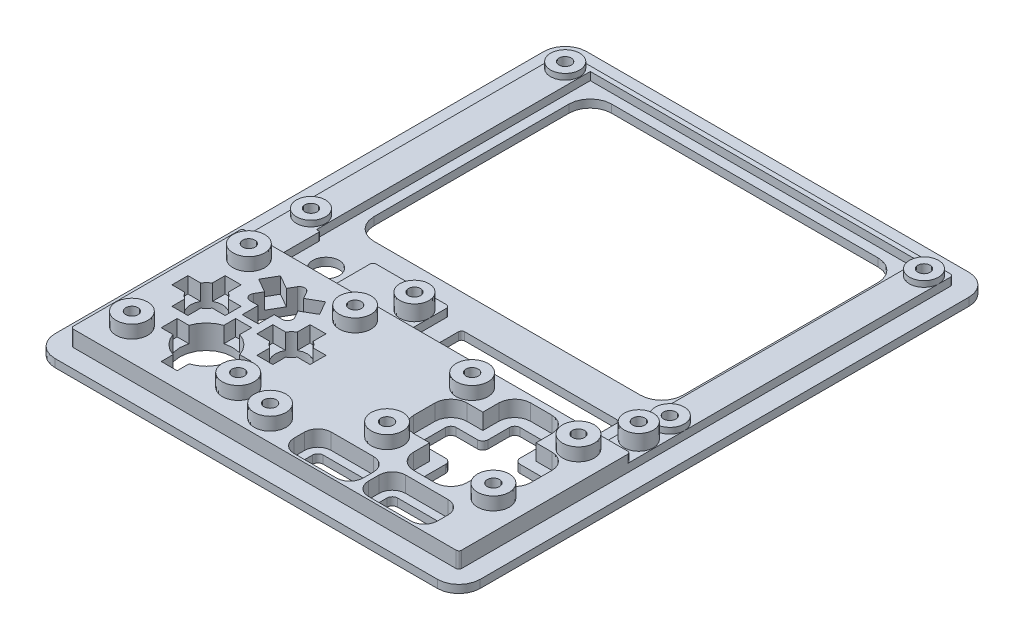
SolidWorks part; units mm, degrees
ref_plane "Front Plane" through (0, 0, 0) normal (0, 0, 1) x (1, 0, 0)
ref_plane "Top Plane" through (0, 0, 0) normal (0, 1, 0) x (1, 0, 0)
ref_plane "Right Plane" through (0, 0, 0) normal (1, 0, 0) x (0, 0, -1)
sketch "Sketch1" plane through (0, 0, 0) normal (0, 1, 0) x (1, 0, 0)
  line L1 (50.8, -63.5) -> (-50.8, -63.5)
  line L2 (50.8, -63.5) -> (50.8, 63.5)
  line L3 (50.8, 63.5) -> (-50.8, 63.5)
  line L4 (-50.8, -63.5) -> (-50.8, 63.5)
  line L5 (50.8, -63.5) -> (-50.8, 63.5) construction
  line L6 (50.8, 63.5) -> (-50.8, -63.5) construction
  point P0 (0, 0)
  dimension "D1" = 101.6
  dimension "D2" = 127
extrude "Boss-Extrude1" add sketch "Sketch1" along normal blind 3.81
fillet "Fillet1" radius 5.08 4 edges at (-50.8, 1.905, -63.5) (50.8, 1.905, -63.5) (-50.8, 1.905, 63.5) (50.8, 1.905, 63.5)
sketch "Sketch2" plane through (0, 3.81, 0) normal (0, 1, 0) x (1, 0, 0)
  line L0 (-46.355, 58.42) -> (-46.355, -58.42)
  line L1 (-45.72, -59.055) -> (45.72, -59.055)
  line L2 (46.355, -58.42) -> (46.355, 58.42)
  line L3 (45.72, 59.055) -> (-45.72, 59.055)
  line L4 (45.72, 63.5) -> (-45.72, 63.5)
  line L5 (-50.8, 58.42) -> (-50.8, -58.42)
  line L6 (-45.72, -63.5) -> (45.72, -63.5)
  line L7 (50.8, -58.42) -> (50.8, 58.42)
  line L8 (45.72, 63.5) -> (-45.72, 63.5)
  line L9 (-50.8, 58.42) -> (-50.8, -58.42)
  line L10 (-45.72, -63.5) -> (45.72, -63.5)
  line L11 (50.8, -58.42) -> (50.8, 58.42)
  arc A0 (-45.72, 59.055) -> (-46.355, 58.42) centre (-45.72, 58.42) ccw
  arc A1 (-46.355, -58.42) -> (-45.72, -59.055) centre (-45.72, -58.42) ccw
  arc A2 (45.72, -59.055) -> (46.355, -58.42) centre (45.72, -58.42) ccw
  arc A3 (46.355, 58.42) -> (45.72, 59.055) centre (45.72, 58.42) ccw
  arc A5 (-45.72, 63.5) -> (-50.8, 58.42) centre (-45.72, 58.42) ccw
  arc A6 (-50.8, -58.42) -> (-45.72, -63.5) centre (-45.72, -58.42) ccw
  arc A7 (45.72, -63.5) -> (50.8, -58.42) centre (45.72, -58.42) ccw
  arc A8 (50.8, 58.42) -> (45.72, 63.5) centre (45.72, 58.42) ccw
  arc A9 (-45.72, 63.5) -> (-50.8, 58.42) centre (-45.72, 58.42) ccw
  arc A10 (-50.8, -58.42) -> (-45.72, -63.5) centre (-45.72, -58.42) ccw
  arc A11 (45.72, -63.5) -> (50.8, -58.42) centre (45.72, -58.42) ccw
  arc A12 (50.8, 58.42) -> (45.72, 63.5) centre (45.72, 58.42) ccw
  dimension "D1" = 0
  dimension "D2" = 4.445
extrude "Cut-Extrude1" cut sketch "Sketch2" against normal blind 1.905
sketch "Sketch3" plane through (0, 3.81, 0) normal (0, 1, 0) x (1, 0, 0)
  line L14 (-39.212, 57.912) -> (-39.212, -7.512)
  line L15 (-38.45, 57.15) -> (38.45, 57.15) construction
  line L16 (-38.45, 57.15) -> (-38.45, -6.75) construction
  line L17 (-38.45, -6.75) -> (38.45, -6.75) construction
  line L18 (38.45, 57.15) -> (38.45, -6.75) construction
  line L19 (-39.212, -7.512) -> (39.212, -7.512)
  line L20 (39.212, 57.912) -> (39.212, -7.512)
  line L21 (-39.212, 57.912) -> (39.212, 57.912)
  dimension "D1" = 0.762
extrude "Cut-Extrude2" cut sketch "Sketch3" against normal blind 1.905
sketch "Sketch4" plane through (0, 0, 0) normal (0, -1, 0) x (1, 0, 0)
  line L19 (36.926, -55.626) -> (36.926, 1.162)
  line L20 (-36.926, -55.626) -> (36.926, -55.626)
  line L21 (-36.926, 1.162) -> (-36.926, -55.626)
  line L22 (36.926, 1.162) -> (-36.926, 1.162)
  line L23 (36.926, -55.626) -> (36.926, 1.162)
  line L24 (-36.926, -55.626) -> (36.926, -55.626)
  line L25 (-36.926, 1.162) -> (-36.926, -55.626)
  line L26 (36.926, 1.162) -> (-36.926, 1.162)
  dimension "D1" = 0.508
extrude "Cut-Extrude3" cut sketch "Sketch4" against normal through all
fillet "Fillet2" radius 5.08 4 edges at (-36.926, 0.9525, 1.162) (36.926, 0.9525, 1.162) (36.926, 0.9525, -55.626) (-36.926, 0.9525, -55.626)
sketch "Sketch6" plane through (0, 3.81, 0) normal (0, 1, 0) x (1, 0, 0)
  line L18 (39.212, -18.0784) -> (39.212, -6.75)
  line L19 (-7.397, -18.0784) -> (39.212, -18.0784)
  line L20 (39.212, -6.75) -> (-7.397, -6.75)
  line L21 (-7.397, -6.75) -> (-7.397, -18.0784)
  line L22 (39.212, -18.0784) -> (39.212, -6.75)
  line L23 (-7.397, -18.0784) -> (39.212, -18.0784)
  line L24 (39.212, -6.75) -> (-7.397, -6.75)
  line L25 (-7.397, -6.75) -> (-7.397, -18.0784)
  dimension "D1" = 0.762
extrude "Cut-Extrude4" cut sketch "Sketch6" against normal up to surface (1.905 mm away)
sketch "Sketch8" plane through (0, 0, 0) normal (0, -1, 0) x (1, 0, 0)
  line L12 (-2.5075, 13.6842) -> (-2.5075, 11.1442) construction
  line L13 (34.3225, 11.1442) -> (34.3225, 13.6842) construction
  line L14 (36.926, 9.036) -> (36.926, 15.7924)
  line L15 (-5.111, 9.036) -> (36.926, 9.036)
  line L16 (36.926, 15.7924) -> (-5.111, 15.7924)
  line L17 (-5.111, 15.7924) -> (-5.111, 9.036)
  line L18 (34.8305, 9.036) -> (34.8305, 15.7924)
  line L19 (-3.0155, 9.036) -> (34.8305, 9.036)
  line L20 (34.8305, 15.7924) -> (-3.0155, 15.7924)
  line L21 (-3.0155, 15.7924) -> (-3.0155, 9.036)
  dimension "D2" = 0.508
  dimension "D3" = 0.508
  dimension "D1" = 1.524
extrude "Cut-Extrude7" cut sketch "Sketch8" against normal up to surface (1.905 mm away)
sketch "Sketch9" plane through (0, 3.81, 0) normal (0, 1, 0) x (1, 0, 0)
  line L0 (-6.635, -17.3164) -> (-6.635, -7.512) construction
  circle A0 centre (-32.035, -12.4142) radius 3.175
  point P4 (-6.635, -12.4142)
  dimension "D1" = 6.35
  dimension "D2" = 25.4
extrude "Cut-Extrude8" cut sketch "Sketch9" against normal up to surface (3.81 mm away)
sketch "Sketch10" plane through (0, 3.81, 0) normal (0, 1, 0) x (1, 0, 0)
  line L1 (-38.385, -18.0784) -> (-25.685, -18.0784)
  line L2 (-38.385, -18.0784) -> (-38.385, -6.75)
  line L3 (-38.385, -6.75) -> (-25.685, -6.75)
  line L4 (-25.685, -18.0784) -> (-25.685, -6.75)
  line L5 (-38.385, -18.0784) -> (-25.685, -6.75) construction
  line L6 (-38.385, -6.75) -> (-25.685, -18.0784) construction
  line L8 (38.45, -6.75) -> (-38.45, -6.75) construction
  point P0 (-32.035, -12.4142)
  dimension "D1" = 12.7
extrude "Cut-Extrude9" cut sketch "Sketch10" against normal up to surface (1.905 mm away)
sketch "Sketch11" plane through (0, 3.81, 0) normal (0, 1, 0) x (1, 0, 0)
  line L0 (-46.355, 58.42) -> (-46.355, -58.42) construction
  line L1 (45.72, 59.055) -> (-45.72, 59.055) construction
  line L2 (0, 57.15) -> (0, -7.512) construction
  line L5 (-39.212, 25.2) -> (39.212, 25.2) construction
  line L6 (-39.212, 57.912) -> (-39.212, -7.512) construction
  line L7 (39.212, -18.0784) -> (39.212, 57.912) construction
  line L8 (-6.635, -7.512) -> (38.45, -7.512) construction
  line L9 (-38.45, 57.15) -> (38.45, 57.15) construction
  circle A0 centre (-42.8625, 55.5625) radius 3.4925
  circle A1 centre (42.8625, 55.5625) radius 3.4925
  circle A2 centre (42.8625, -5.1625) radius 3.4925
  circle A3 centre (-42.8625, -5.1625) radius 3.4925
  dimension "D1" = 6.985
extrude "Boss-Extrude2" add sketch "Sketch11" along normal up to surface (1.397 mm away)
hole_wizard "#4 Clearance Hole1" positions "Sketch13" profile "Sketch12" hole size "#4" standard "ANSI Inch"
sketch "Sketch13" plane through (0, 5.207, 0) normal (0, 1, 0) x (1, 0, 0)
  point P0 (-42.8625, 55.5625)
  point P3 (42.8625, 55.5625)
  point P6 (-42.8625, -5.1625)
  point P9 (42.8625, -5.1625)
sketch "Sketch12" plane through (-42.8625, 5.207, -55.5625) normal (1, 0, 0) x (0, 0, 1)
  line L0 (0, 0) -> (0, 4.6952)
  line L1 (0, 4.6952) -> (1.4732, 3.81)
  line L2 (1.4732, 3.81) -> (1.4732, 0)
  line L5 (1.4732, 0) -> (0, 0)
  line L10 (0, 4.6952) -> (-1.4732, 3.81) construction
  line L11 (0, -6.35) -> (0, 107.95) construction
  dimension "Hole Dia." = 2.9464
  dimension "Hole Depth" = 3.81
  dimension "Drill Angle" = 118
fillet "Fillet3" radius 0.762 10 edges at (-3.0155, 0.9525, 15.7924) (34.8305, 0.9525, 15.7924) (34.8305, 0.9525, 9.036) (-3.0155, 0.9525, 9.036) (39.212, 2.8575, 18.0784) (-7.397, 2.8575, 18.0784) (-7.397, 2.8575, 7.512) (-25.685, 2.8575, 7.512) (-25.685, 2.8575, 18.0784) (-38.385, 2.8575, 18.0784)
sketch "Sketch14" plane through (0, 0, 0) normal (0, -1, 0) x (-1, 0, 0)
  line L1 (26.655, -21.59) -> (20.6058, -32.0675)
  line L2 (20.6058, -32.0675) -> (32.7042, -32.0675)
  line L3 (32.7042, -32.0675) -> (26.655, -21.59)
  circle A0 centre (16.495, -36.195) radius 3.81
  circle A1 centre (36.785, -36.195) radius 3.81
  circle A2 centre (26.655, -46.355) radius 6.35
  circle A3 centre (26.655, -28.575) radius 3.4925 construction
  dimension "D1" = 12.7
  dimension "D2" = 7.62
  dimension "D3" = 6.985
extrude "Cut-Extrude10" cut sketch "Sketch14" against normal up to surface (3.81 mm away)
fillet "Fillet4" radius 1.27 3 edges at (-32.7042, 1.905, 32.0675) (-20.6058, 1.905, 32.0675) (-26.655, 1.905, 21.59)
sketch "Sketch15" plane through (0, 0, 0) normal (0, -1, 0) x (1, 0, 0)
  line L0 (26.685, 26.035) -> (26.685, 41.275) construction
  line L1 (34.275, 33.655) -> (19.065, 33.655) construction
  line L2 (30.495, 29.845) -> (30.495, 22.225)
  line L3 (38.115, 37.465) -> (30.495, 37.465)
  line L4 (38.115, 37.465) -> (38.115, 29.845)
  line L5 (38.115, 29.845) -> (30.495, 29.845)
  line L6 (15.255, 37.465) -> (15.255, 29.845)
  line L7 (38.115, 37.465) -> (15.255, 29.845) construction
  line L8 (38.115, 29.845) -> (15.255, 37.465) construction
  line L9 (22.875, 45.085) -> (30.495, 45.085)
  line L10 (22.875, 45.085) -> (22.875, 37.465)
  line L11 (22.875, 22.225) -> (30.495, 22.225)
  line L12 (30.495, 45.085) -> (30.495, 37.465)
  line L13 (22.875, 45.085) -> (30.495, 22.225) construction
  line L14 (22.875, 22.225) -> (30.495, 45.085) construction
  line L15 (22.875, 29.845) -> (15.255, 29.845)
  line L16 (22.875, 29.845) -> (22.875, 22.225)
  line L17 (22.875, 37.465) -> (15.255, 37.465)
  point P14 (26.685, 33.655)
  point P19 (26.685, 33.655)
  dimension "D1" = 22.86
  dimension "D2" = 7.62
  dimension "D3" = 22.86
  dimension "D4" = 7.62
extrude "Cut-Extrude11" cut sketch "Sketch15" against normal up to surface (3.81 mm away)
fillet "Fillet5" radius 1.27 12 edges at (22.875, 1.905, 29.845) (15.255, 1.905, 29.845) (15.255, 1.905, 37.465) (22.875, 1.905, 37.465) (22.875, 1.905, 45.085) (30.495, 1.905, 45.085) (30.495, 1.905, 37.465) (38.115, 1.905, 37.465) (38.115, 1.905, 29.845) (30.495, 1.905, 22.225) (22.875, 1.905, 22.225) (30.495, 1.905, 29.845)
sketch "Sketch16" plane through (0, 0, 0) normal (0, -1, 0) x (1, 0, 0)
  line L1 (35.545, 56.515) -> (22.845, 56.515)
  line L2 (35.545, 56.515) -> (35.545, 51.435)
  line L3 (35.545, 51.435) -> (22.845, 51.435)
  line L4 (22.845, 56.515) -> (22.845, 51.435)
  line L5 (35.545, 56.515) -> (22.845, 51.435) construction
  line L6 (35.545, 51.435) -> (22.845, 56.515) construction
  line L7 (5.065, 56.515) -> (17.765, 56.515)
  line L8 (5.065, 56.515) -> (5.065, 51.435)
  line L9 (5.065, 51.435) -> (17.765, 51.435)
  line L10 (17.765, 56.515) -> (17.765, 51.435)
  line L11 (5.065, 56.515) -> (17.765, 51.435) construction
  line L12 (5.065, 51.435) -> (17.765, 56.515) construction
  point P0 (29.195, 53.975)
  point P6 (11.415, 53.975)
  dimension "D1" = 12.7
  dimension "D2" = 5.08
extrude "Cut-Extrude12" cut sketch "Sketch16" against normal up to surface (3.81 mm away)
fillet "Fillet7" radius 1.27 4 edges at (22.845, 1.905, 51.435) (22.845, 1.905, 56.515) (35.545, 1.905, 56.515) (35.545, 1.905, 51.435)
fillet "Fillet8" radius 1.27 4 edges at (17.765, 1.905, 56.515) (5.065, 1.905, 51.435) (5.065, 1.905, 56.515) (17.765, 1.905, 51.435)
fillet "Fillet9" radius 0.254 2 edges at (-38.385, 2.8575, 7.512) (-39.212, 2.8575, 7.512)
sketch "Sketch17" plane through (0, 3.81, 0) normal (0, 1, 0) x (1, 0, 0)
  line L0 (-28.7271, -25.179) -> (-30.6321, -28.4785)
  line L1 (-22.845, -38.1) -> (-10.145, -38.1)
  line L2 (-22.845, -38.1) -> (-22.845, -34.29)
  line L3 (-22.845, -34.29) -> (-10.145, -34.29)
  line L4 (-10.145, -38.1) -> (-10.145, -34.29)
  line L5 (-22.845, -38.1) -> (-10.145, -34.29) construction
  line L6 (-22.845, -34.29) -> (-10.145, -38.1) construction
  line L7 (-43.135, -38.1) -> (-30.435, -38.1)
  line L8 (-43.135, -38.1) -> (-43.135, -34.29)
  line L9 (-43.135, -34.29) -> (-30.435, -34.29)
  line L10 (-30.435, -38.1) -> (-30.435, -34.29)
  line L11 (-43.135, -38.1) -> (-30.435, -34.29) construction
  line L12 (-43.135, -34.29) -> (-30.435, -38.1) construction
  line L13 (-28.7271, -25.179) -> (-32.0267, -23.274)
  line L14 (-30.6321, -28.4785) -> (-33.9317, -26.5735)
  line L15 (-32.0267, -23.274) -> (-33.9317, -26.5735)
  line L16 (-31.6043, -30.1625) -> (-27.7549, -23.495) construction
  line L17 (-24.5829, -25.179) -> (-21.2833, -23.274)
  line L18 (-24.5829, -25.179) -> (-22.6779, -28.4785)
  line L19 (-21.2833, -23.274) -> (-19.3783, -26.5735)
  line L20 (-22.6779, -28.4785) -> (-19.3783, -26.5735)
  line L21 (-25.5551, -23.495) -> (-21.7057, -30.1625) construction
  line L23 (-34.88, -42.545) -> (-38.69, -42.545)
  line L24 (-34.88, -42.545) -> (-34.88, -29.845)
  line L25 (-34.88, -29.845) -> (-38.69, -29.845)
  line L26 (-38.69, -42.545) -> (-38.69, -29.845)
  line L27 (-34.88, -42.545) -> (-38.69, -29.845) construction
  line L28 (-34.88, -29.845) -> (-38.69, -42.545) construction
  line L29 (-14.59, -42.545) -> (-18.4, -42.545)
  line L30 (-14.59, -42.545) -> (-14.59, -29.845)
  line L31 (-14.59, -29.845) -> (-18.4, -29.845)
  line L32 (-18.4, -42.545) -> (-18.4, -29.845)
  line L33 (-14.59, -42.545) -> (-18.4, -29.845) construction
  line L34 (-14.59, -29.845) -> (-18.4, -42.545) construction
  line L35 (-28.56, -32.0675) -> (-24.75, -32.0675)
  line L36 (-28.56, -32.0675) -> (-28.56, -35.8775)
  line L37 (-28.56, -35.8775) -> (-24.75, -35.8775)
  line L38 (-24.75, -32.0675) -> (-24.75, -35.8775)
  line L39 (-22.8055, -32.0675) -> (-30.5045, -32.0675) construction
  line L40 (19.67, -55.245) -> (19.67, -52.705)
  line L41 (6.335, -58.42) -> (16.495, -58.42)
  line L42 (3.16, -52.705) -> (3.16, -55.245)
  line L43 (16.495, -49.53) -> (6.335, -49.53)
  line L44 (19.67, -55.245) -> (19.67, -52.705)
  line L45 (6.335, -58.42) -> (16.495, -58.42)
  line L46 (3.16, -52.705) -> (3.16, -55.245)
  line L47 (16.495, -49.53) -> (6.335, -49.53)
  line L48 (-24.75, -55.245) -> (-28.56, -55.245)
  line L49 (-24.75, -55.245) -> (-24.75, -37.465)
  line L50 (-24.75, -37.465) -> (-28.56, -37.465)
  line L51 (-28.56, -55.245) -> (-28.56, -37.465)
  line L52 (20.94, -52.705) -> (20.94, -55.245)
  line L53 (34.275, -49.53) -> (24.115, -49.53)
  line L54 (37.45, -55.245) -> (37.45, -52.705)
  line L55 (24.115, -58.42) -> (34.275, -58.42)
  line L56 (20.94, -52.705) -> (20.94, -55.245)
  line L57 (34.275, -49.53) -> (24.115, -49.53)
  line L58 (37.45, -55.245) -> (37.45, -52.705)
  line L59 (24.115, -58.42) -> (34.275, -58.42)
  line L60 (-24.75, -55.245) -> (-28.56, -37.465) construction
  line L61 (-24.75, -37.465) -> (-28.56, -55.245) construction
  line L62 (-35.545, -48.26) -> (-17.765, -48.26)
  line L63 (-35.545, -48.26) -> (-35.545, -44.45)
  line L64 (-35.545, -44.45) -> (-17.765, -44.45)
  line L65 (-17.765, -48.26) -> (-17.765, -44.45)
  line L66 (-35.545, -48.26) -> (-17.765, -44.45) construction
  line L67 (-35.545, -44.45) -> (-17.765, -48.26) construction
  line L92 (20.335, -27.305) -> (16.525, -27.305)
  line L93 (20.335, -23.495) -> (20.335, -27.305)
  line L94 (29.225, -19.685) -> (24.145, -19.685)
  line L95 (33.035, -27.305) -> (33.035, -23.495)
  line L96 (36.845, -27.305) -> (33.035, -27.305)
  line L97 (40.655, -36.195) -> (40.655, -31.115)
  line L98 (33.035, -40.005) -> (36.845, -40.005)
  line L99 (33.035, -43.815) -> (33.035, -40.005)
  line L100 (24.145, -47.625) -> (29.225, -47.625)
  line L101 (20.335, -40.005) -> (20.335, -43.815)
  line L102 (16.525, -40.005) -> (20.335, -40.005)
  line L103 (12.715, -31.115) -> (12.715, -36.195)
  line L104 (20.335, -27.305) -> (16.525, -27.305)
  line L105 (20.335, -23.495) -> (20.335, -27.305)
  line L106 (29.225, -19.685) -> (24.145, -19.685)
  line L107 (33.035, -27.305) -> (33.035, -23.495)
  line L108 (36.845, -27.305) -> (33.035, -27.305)
  line L109 (40.655, -36.195) -> (40.655, -31.115)
  line L110 (33.035, -40.005) -> (36.845, -40.005)
  line L111 (33.035, -43.815) -> (33.035, -40.005)
  line L112 (24.145, -47.625) -> (29.225, -47.625)
  line L113 (20.335, -40.005) -> (20.335, -43.815)
  line L114 (16.525, -40.005) -> (20.335, -40.005)
  line L115 (12.715, -31.115) -> (12.715, -36.195)
  circle A1 centre (-36.785, -36.195) radius 3.81 construction
  circle A2 centre (-26.655, -46.355) radius 6.35 construction
  arc A65 (16.495, -58.42) -> (19.67, -55.245) centre (16.495, -55.245) ccw
  arc A66 (16.495, -58.42) -> (19.67, -55.245) centre (16.495, -55.245) ccw
  arc A67 (3.16, -55.245) -> (6.335, -58.42) centre (6.335, -55.245) ccw
  arc A68 (3.16, -55.245) -> (6.335, -58.42) centre (6.335, -55.245) ccw
  arc A73 (24.115, -49.53) -> (20.94, -52.705) centre (24.115, -52.705) ccw
  arc A74 (37.45, -52.705) -> (34.275, -49.53) centre (34.275, -52.705) ccw
  arc A75 (34.275, -58.42) -> (37.45, -55.245) centre (34.275, -55.245) ccw
  arc A76 (20.94, -55.245) -> (24.115, -58.42) centre (24.115, -55.245) ccw
  arc A77 (24.115, -49.53) -> (20.94, -52.705) centre (24.115, -52.705) ccw
  arc A78 (37.45, -52.705) -> (34.275, -49.53) centre (34.275, -52.705) ccw
  arc A79 (34.275, -58.42) -> (37.45, -55.245) centre (34.275, -55.245) ccw
  arc A80 (20.94, -55.245) -> (24.115, -58.42) centre (24.115, -55.245) ccw
  arc A89 (6.335, -49.53) -> (3.16, -52.705) centre (6.335, -52.705) ccw
  arc A90 (6.335, -49.53) -> (3.16, -52.705) centre (6.335, -52.705) ccw
  arc A91 (19.67, -52.705) -> (16.495, -49.53) centre (16.495, -52.705) ccw
  arc A92 (19.67, -52.705) -> (16.495, -49.53) centre (16.495, -52.705) ccw
  arc A113 (24.145, -19.685) -> (20.335, -23.495) centre (24.145, -23.495) ccw
  arc A114 (33.035, -23.495) -> (29.225, -19.685) centre (29.225, -23.495) ccw
  arc A115 (40.655, -31.115) -> (36.845, -27.305) centre (36.845, -31.115) ccw
  arc A116 (36.845, -40.005) -> (40.655, -36.195) centre (36.845, -36.195) ccw
  arc A117 (29.225, -47.625) -> (33.035, -43.815) centre (29.225, -43.815) ccw
  arc A118 (20.335, -43.815) -> (24.145, -47.625) centre (24.145, -43.815) ccw
  arc A119 (12.715, -36.195) -> (16.525, -40.005) centre (16.525, -36.195) ccw
  arc A120 (16.525, -27.305) -> (12.715, -31.115) centre (16.525, -31.115) ccw
  arc A121 (24.145, -19.685) -> (20.335, -23.495) centre (24.145, -23.495) ccw
  arc A122 (33.035, -23.495) -> (29.225, -19.685) centre (29.225, -23.495) ccw
  arc A123 (40.655, -31.115) -> (36.845, -27.305) centre (36.845, -31.115) ccw
  arc A124 (36.845, -40.005) -> (40.655, -36.195) centre (36.845, -36.195) ccw
  arc A125 (29.225, -47.625) -> (33.035, -43.815) centre (29.225, -43.815) ccw
  arc A126 (20.335, -43.815) -> (24.145, -47.625) centre (24.145, -43.815) ccw
  arc A127 (12.715, -36.195) -> (16.525, -40.005) centre (16.525, -36.195) ccw
  arc A128 (16.525, -27.305) -> (12.715, -31.115) centre (16.525, -31.115) ccw
  point P2 (-16.495, -36.195)
  point P7 (-36.785, -36.195)
  point P26 (-36.785, -36.195)
  point P31 (-16.495, -36.195)
  point P52 (-26.655, -32.0675)
  point P53 (-26.655, -32.0675)
  point P56 (-29.6796, -26.8288)
  point P57 (-29.6796, -26.8288)
  point P58 (-23.6304, -26.8288)
  point P59 (-23.6304, -26.8288)
  point P62 (-26.655, -46.355)
  point P67 (-26.655, -46.355)
  dimension "D4" = 2.54
  dimension "D8" = 2.54
  dimension "D9" = 2.54
  dimension "D1" = 3.81
  dimension "D2" = 3.81
  dimension "D3" = 2.54
  dimension "D5" = 1.905
  dimension "D6" = 1.905
  dimension "D7" = 2.54
extrude "Cut-Extrude13" cut sketch "Sketch17" against normal blind 1.905 contours L104 A128 L115 A127 L114 L113 A126 L112 A125 L111 L110 A124 L109 A123 L108 L107 A122 L106 A121 L105 | L44 A92 L47 A90 L46 A68 L45 A66 | L56 A80 L59 A79 L58 A78 L57 A77 | L51 L64 L49 L50 | L64 L51 L62 L49 | L62 L51 L48 L49 | L64 L63 L62 L51 | L62 L65 L64 L49 | L1 L32 L3 L2 | L32 L29 L30 L1 | L32 L1 L30 L3 | L32 L3 L30 L31 | L30 L1 L4 L3 | L38 L35 L36 L37 | L13 L15 L14 L0 | L18 L20 L19 L17 | L26 L9 L24 L25 | L7 L26 L9 L8 | L26 L23 L24 L7 | L26 L7 L24 L9 | L24 L7 L10 L9
sketch "Sketch18" plane through (0, 3.81, 0) normal (0, 1, 0) x (1, 0, 0)
  circle A0 centre (-39.37, -23.495) radius 3.81
  circle A1 centre (-13.97, -23.495) radius 3.81
  circle A2 centre (-39.37, -51.435) radius 3.81
  circle A3 centre (-13.97, -51.435) radius 3.81
  circle A4 centre (13.97, -43.815) radius 3.81
  circle A5 centre (-3.81, -53.975) radius 3.81
  circle A6 centre (39.37, -43.815) radius 3.81
  circle A7 centre (13.97, -23.495) radius 3.81
  circle A8 centre (39.37, -23.495) radius 3.81
  dimension "D1" = 7.62
extrude "Boss-Extrude3" add sketch "Sketch18" along normal up to surface (5 mm away)
hole_wizard "#4 Clearance Hole2" positions "Sketch20" profile "Sketch19" hole size "#4" standard "ANSI Inch"
sketch "Sketch20" plane through (0, 8.81, 0) normal (0, 1, 0) x (1, 0, 0)
  point P0 (-39.37, -51.435)
  point P3 (-39.37, -23.495)
  point P6 (-13.97, -23.495)
  point P9 (-13.97, -51.435)
  point P12 (-3.81, -53.975)
  point P15 (13.97, -43.815)
  point P18 (13.97, -23.495)
  point P21 (39.37, -23.495)
  point P24 (39.37, -43.815)
sketch "Sketch19" plane through (-39.37, 8.81, 51.435) normal (1, 0, 0) x (0, 0, 1)
  line L0 (0, 0) -> (0, 7.8702)
  line L1 (0, 7.8702) -> (1.4732, 6.985)
  line L2 (1.4732, 6.985) -> (1.4732, 0)
  line L5 (1.4732, 0) -> (0, 0)
  line L10 (0, 7.8702) -> (-1.4732, 6.985) construction
  line L11 (0, -6.35) -> (0, 107.95) construction
  dimension "Hole Dia." = 2.9464
  dimension "Hole Depth" = 6.985
  dimension "Drill Angle" = 118
sketch "Sketch21" plane through (0, 3.81, 0) normal (0, 1, 0) x (1, 0, 0)
  line L0 (-6.635, -17.3164) -> (-6.635, -7.512) construction
  line L1 (15.9075, -7.512) -> (15.9075, -17.3164) construction
  line L2 (-6.635, -7.512) -> (38.45, -7.512) construction
  line L3 (38.45, -17.3164) -> (-6.635, -17.3164) construction
  line L4 (39.212, -17.3164) -> (39.212, 57.912) construction
  circle A0 centre (-10.8895, -12.4142) radius 3.4925
  circle A1 centre (42.7045, -12.4142) radius 3.4925
  point P6 (-6.635, -12.4142)
  dimension "D1" = 6.985
extrude "Boss-Extrude4" add sketch "Sketch21" along normal up to surface (3.683 mm away)
hole_wizard "#4 Clearance Hole3" positions "Sketch23" profile "Sketch22" hole size "#4" standard "ANSI Inch"
sketch "Sketch23" plane through (0, 7.493, 0) normal (0, 1, 0) x (1, 0, 0)
  point P0 (-10.8895, -12.4142)
  point P3 (42.7045, -12.4142)
sketch "Sketch22" plane through (-10.8895, 7.493, 12.4142) normal (1, 0, 0) x (0, 0, 1)
  line L0 (0, 0) -> (0, 5.4572)
  line L1 (0, 5.4572) -> (1.4732, 4.572)
  line L2 (1.4732, 4.572) -> (1.4732, 0)
  line L5 (1.4732, 0) -> (0, 0)
  line L10 (0, 5.4572) -> (-1.4732, 4.572) construction
  line L11 (0, -6.35) -> (0, 107.95) construction
  dimension "Hole Dia." = 2.9464
  dimension "Hole Depth" = 4.572
  dimension "Drill Angle" = 118
sketch "Sketch24" plane through (0, 3.81, 0) normal (0, 1, 0) x (1, 0, 0)
  line L1 (-28.7271, -25.179) -> (-27.7549, -23.495) construction
  line L2 (-31.6043, -30.1625) -> (-30.6321, -28.4785) construction
  line L3 (-28.56, -32.0675) -> (-30.5045, -32.0675) construction
  line L4 (-28.56, -32.0675) -> (-28.56, -35.8775) construction
  line L5 (-28.7271, -25.179) -> (-32.0267, -23.274)
  line L6 (-32.0267, -23.274) -> (-33.9317, -26.5735)
  line L7 (-33.9317, -26.5735) -> (-30.6321, -28.4785)
  line L8 (-30.6321, -28.4785) -> (-28.7271, -25.179)
  line L9 (-28.7271, -25.179) -> (-32.0267, -23.274)
  line L10 (-32.0267, -23.274) -> (-33.9317, -26.5735)
  line L11 (-33.9317, -26.5735) -> (-30.6321, -28.4785)
  line L12 (-38.69, -29.845) -> (-38.69, -32.8954)
  line L13 (-34.88, -29.845) -> (-38.69, -29.845)
  line L14 (-34.88, -32.8954) -> (-34.88, -29.845)
  line L15 (-30.435, -34.29) -> (-33.4854, -34.29)
  line L16 (-30.435, -38.1) -> (-30.435, -34.29)
  line L17 (-33.4854, -38.1) -> (-30.435, -38.1)
  line L18 (-34.88, -42.545) -> (-34.88, -39.4946)
  line L19 (-38.69, -42.545) -> (-34.88, -42.545)
  line L20 (-38.69, -39.4946) -> (-38.69, -42.545)
  line L21 (-43.135, -38.1) -> (-40.0846, -38.1)
  line L22 (-43.135, -34.29) -> (-43.135, -38.1)
  line L23 (-40.0846, -34.29) -> (-43.135, -34.29)
  line L24 (-38.69, -29.845) -> (-38.69, -32.8954)
  line L25 (-34.88, -29.845) -> (-38.69, -29.845)
  line L26 (-34.88, -32.8954) -> (-34.88, -29.845)
  line L27 (-30.435, -34.29) -> (-33.4854, -34.29)
  line L28 (-30.435, -38.1) -> (-30.435, -34.29)
  line L29 (-33.4854, -38.1) -> (-30.435, -38.1)
  line L30 (-34.88, -42.545) -> (-34.88, -39.4946)
  line L31 (-38.69, -42.545) -> (-34.88, -42.545)
  line L32 (-38.69, -39.4946) -> (-38.69, -42.545)
  line L33 (-43.135, -38.1) -> (-40.0846, -38.1)
  line L34 (-43.135, -34.29) -> (-43.135, -38.1)
  line L35 (-40.0846, -34.29) -> (-43.135, -34.29)
  line L36 (-28.56, -35.8775) -> (-24.75, -35.8775) construction
  line L37 (-24.75, -32.0675) -> (-24.75, -35.8775) construction
  line L38 (-22.8055, -32.0675) -> (-24.75, -32.0675) construction
  line L39 (-22.6779, -28.4785) -> (-21.7057, -30.1625) construction
  line L40 (-22.6779, -28.4785) -> (-19.3783, -26.5735) construction
  line L41 (-21.2833, -23.274) -> (-19.3783, -26.5735) construction
  line L42 (-24.5829, -25.179) -> (-21.2833, -23.274) construction
  line L43 (-28.7271, -25.179) -> (-27.7549, -23.495)
  line L44 (-31.6043, -30.1625) -> (-30.6321, -28.4785)
  line L45 (-28.56, -32.0675) -> (-30.5045, -32.0675)
  line L46 (-28.56, -32.0675) -> (-28.56, -35.8775)
  line L47 (-28.56, -35.8775) -> (-24.75, -35.8775)
  line L48 (-24.75, -32.0675) -> (-24.75, -35.8775)
  line L49 (-22.8055, -32.0675) -> (-24.75, -32.0675)
  line L50 (-22.6779, -28.4785) -> (-21.7057, -30.1625)
  line L51 (-22.6779, -28.4785) -> (-19.3783, -26.5735)
  line L52 (-21.2833, -23.274) -> (-19.3783, -26.5735)
  line L53 (-24.5829, -25.179) -> (-21.2833, -23.274)
  line L55 (-35.545, -48.26) -> (-35.545, -44.45) construction
  line L56 (-35.545, -44.45) -> (-32.7125, -44.45) construction
  line L57 (-28.56, -40.2975) -> (-28.56, -37.465) construction
  line L58 (-24.75, -37.465) -> (-28.56, -37.465) construction
  line L59 (-24.75, -40.2975) -> (-24.75, -37.465) construction
  line L60 (-20.5975, -44.45) -> (-17.765, -44.45) construction
  line L61 (-17.765, -48.26) -> (-17.765, -44.45) construction
  line L62 (-20.5975, -48.26) -> (-17.765, -48.26) construction
  line L63 (-35.545, -48.26) -> (-32.7125, -48.26) construction
  line L64 (-28.56, -55.245) -> (-28.56, -52.4125) construction
  line L65 (-24.75, -55.245) -> (-28.56, -55.245) construction
  line L66 (-22.845, -38.1) -> (-19.7946, -38.1)
  line L67 (-22.845, -34.29) -> (-22.845, -38.1)
  line L68 (-19.7946, -34.29) -> (-22.845, -34.29)
  line L69 (-18.4, -29.845) -> (-18.4, -32.8954)
  line L70 (-14.59, -29.845) -> (-18.4, -29.845)
  line L71 (-14.59, -32.8954) -> (-14.59, -29.845)
  line L72 (-10.145, -34.29) -> (-13.1954, -34.29)
  line L73 (-10.145, -38.1) -> (-10.145, -34.29)
  line L74 (-13.1954, -38.1) -> (-10.145, -38.1)
  line L75 (-14.59, -42.545) -> (-14.59, -39.4946)
  line L76 (-18.4, -42.545) -> (-14.59, -42.545)
  line L77 (-18.4, -39.4946) -> (-18.4, -42.545)
  line L78 (-22.845, -38.1) -> (-19.7946, -38.1)
  line L79 (-22.845, -34.29) -> (-22.845, -38.1)
  line L80 (-19.7946, -34.29) -> (-22.845, -34.29)
  line L81 (-18.4, -29.845) -> (-18.4, -32.8954)
  line L82 (-14.59, -29.845) -> (-18.4, -29.845)
  line L83 (-14.59, -32.8954) -> (-14.59, -29.845)
  line L84 (-10.145, -34.29) -> (-13.1954, -34.29)
  line L85 (-10.145, -38.1) -> (-10.145, -34.29)
  line L86 (-13.1954, -38.1) -> (-10.145, -38.1)
  line L87 (-14.59, -42.545) -> (-14.59, -39.4946)
  line L88 (-18.4, -42.545) -> (-14.59, -42.545)
  line L89 (-18.4, -39.4946) -> (-18.4, -42.545)
  line L90 (-24.75, -55.245) -> (-24.75, -52.4125) construction
  line L91 (-35.545, -48.26) -> (-35.545, -44.45)
  line L92 (-35.545, -44.45) -> (-32.7125, -44.45)
  line L93 (-28.56, -40.2975) -> (-28.56, -37.465)
  line L94 (-24.75, -37.465) -> (-28.56, -37.465)
  line L95 (-24.75, -40.2975) -> (-24.75, -37.465)
  line L96 (-20.5975, -44.45) -> (-17.765, -44.45)
  line L97 (-17.765, -48.26) -> (-17.765, -44.45)
  line L98 (-20.5975, -48.26) -> (-17.765, -48.26)
  line L99 (-35.545, -48.26) -> (-32.7125, -48.26)
  line L100 (-28.56, -55.245) -> (-28.56, -52.4125)
  line L101 (-24.75, -55.245) -> (-28.56, -55.245)
  line L102 (-24.75, -55.245) -> (-24.75, -52.4125)
  line L103 (-26.655, -35.8775) -> (-26.655, -37.465) construction
  line L104 (-46.355, 58.42) -> (-46.355, -58.42) construction
  line L109 (-45.72, -59.055) -> (45.72, -59.055) construction
  line L110 (46.355, -58.42) -> (46.355, 58.42) construction
  line L111 (-46.355, -18.7134) -> (-46.355, -58.42)
  line L112 (19.67, -55.245) -> (19.67, -52.705)
  line L113 (6.335, -58.42) -> (16.495, -58.42)
  line L114 (3.16, -52.705) -> (3.16, -55.245)
  line L115 (16.495, -49.53) -> (6.335, -49.53)
  line L116 (19.67, -55.245) -> (19.67, -52.705)
  line L117 (6.335, -58.42) -> (16.495, -58.42)
  line L118 (-25.5551, -23.495) -> (-24.5829, -25.179) construction
  line L119 (-25.5551, -23.495) -> (-24.5829, -25.179)
  line L120 (3.16, -52.705) -> (3.16, -55.245)
  line L121 (16.495, -49.53) -> (6.335, -49.53)
  line L122 (-45.72, -59.055) -> (45.72, -59.055)
  line L123 (20.94, -52.705) -> (20.94, -55.245)
  line L124 (34.275, -49.53) -> (24.115, -49.53)
  line L125 (37.45, -55.245) -> (37.45, -52.705)
  line L126 (24.115, -58.42) -> (34.275, -58.42)
  line L127 (20.94, -52.705) -> (20.94, -55.245)
  line L128 (34.275, -49.53) -> (24.115, -49.53)
  line L129 (37.45, -55.245) -> (37.45, -52.705)
  line L130 (24.115, -58.42) -> (34.275, -58.42)
  line L131 (46.355, -58.42) -> (46.355, -18.7134)
  line L132 (-45.72, -18.0784) -> (45.72, -18.0784)
  line L133 (-6.635, -18.0784) -> (38.45, -18.0784) construction
  line L139 (20.335, -27.305) -> (16.525, -27.305)
  line L140 (12.715, -31.115) -> (12.715, -36.195)
  line L141 (16.525, -40.005) -> (20.335, -40.005)
  line L142 (20.335, -40.005) -> (20.335, -43.815)
  line L143 (24.145, -47.625) -> (29.225, -47.625)
  line L144 (33.035, -43.815) -> (33.035, -40.005)
  line L145 (33.035, -40.005) -> (36.845, -40.005)
  line L146 (40.655, -36.195) -> (40.655, -31.115)
  line L147 (36.845, -27.305) -> (33.035, -27.305)
  line L148 (33.035, -27.305) -> (33.035, -23.495)
  line L149 (29.225, -19.685) -> (24.145, -19.685)
  line L150 (20.335, -23.495) -> (20.335, -27.305)
  line L151 (20.335, -27.305) -> (16.525, -27.305)
  line L152 (12.715, -31.115) -> (12.715, -36.195)
  line L153 (16.525, -40.005) -> (20.335, -40.005)
  line L154 (20.335, -40.005) -> (20.335, -43.815)
  line L155 (24.145, -47.625) -> (29.225, -47.625)
  line L156 (33.035, -43.815) -> (33.035, -40.005)
  line L157 (33.035, -40.005) -> (36.845, -40.005)
  line L158 (40.655, -36.195) -> (40.655, -31.115)
  line L159 (36.845, -27.305) -> (33.035, -27.305)
  line L160 (33.035, -27.305) -> (33.035, -23.495)
  line L161 (29.225, -19.685) -> (24.145, -19.685)
  line L162 (20.335, -23.495) -> (20.335, -27.305)
  arc A0 (-25.5551, -23.495) -> (-27.7549, -23.495) centre (-26.655, -24.13) ccw construction
  arc A1 (-31.6043, -30.1625) -> (-30.5045, -32.0675) centre (-30.5045, -30.7975) ccw construction
  arc A2 (-22.8055, -32.0675) -> (-21.7057, -30.1625) centre (-22.8055, -30.7975) ccw construction
  arc A3 (-25.5551, -23.495) -> (-27.7549, -23.495) centre (-26.655, -24.13) ccw
  arc A4 (-38.69, -32.8954) -> (-40.0846, -34.29) centre (-36.785, -36.195) ccw
  arc A5 (-33.4854, -34.29) -> (-34.88, -32.8954) centre (-36.785, -36.195) ccw
  arc A6 (-34.88, -39.4946) -> (-33.4854, -38.1) centre (-36.785, -36.195) ccw
  arc A7 (-40.0846, -38.1) -> (-38.69, -39.4946) centre (-36.785, -36.195) ccw
  arc A8 (-38.69, -32.8954) -> (-40.0846, -34.29) centre (-36.785, -36.195) ccw
  arc A9 (-33.4854, -34.29) -> (-34.88, -32.8954) centre (-36.785, -36.195) ccw
  arc A10 (-34.88, -39.4946) -> (-33.4854, -38.1) centre (-36.785, -36.195) ccw
  arc A11 (-40.0846, -38.1) -> (-38.69, -39.4946) centre (-36.785, -36.195) ccw
  arc A12 (-31.6043, -30.1625) -> (-30.5045, -32.0675) centre (-30.5045, -30.7975) ccw
  arc A13 (-22.8055, -32.0675) -> (-21.7057, -30.1625) centre (-22.8055, -30.7975) ccw
  arc A14 (-28.56, -40.2975) -> (-32.7125, -44.45) centre (-26.655, -46.355) ccw construction
  arc A15 (-20.5975, -44.45) -> (-24.75, -40.2975) centre (-26.655, -46.355) ccw construction
  arc A16 (-32.7125, -48.26) -> (-28.56, -52.4125) centre (-26.655, -46.355) ccw construction
  arc A17 (-24.75, -52.4125) -> (-20.5975, -48.26) centre (-26.655, -46.355) ccw construction
  arc A18 (-18.4, -32.8954) -> (-19.7946, -34.29) centre (-16.495, -36.195) ccw
  arc A19 (-13.1954, -34.29) -> (-14.59, -32.8954) centre (-16.495, -36.195) ccw
  arc A20 (-14.59, -39.4946) -> (-13.1954, -38.1) centre (-16.495, -36.195) ccw
  arc A21 (-19.7946, -38.1) -> (-18.4, -39.4946) centre (-16.495, -36.195) ccw
  arc A22 (-18.4, -32.8954) -> (-19.7946, -34.29) centre (-16.495, -36.195) ccw
  arc A23 (-13.1954, -34.29) -> (-14.59, -32.8954) centre (-16.495, -36.195) ccw
  arc A24 (-14.59, -39.4946) -> (-13.1954, -38.1) centre (-16.495, -36.195) ccw
  arc A25 (-19.7946, -38.1) -> (-18.4, -39.4946) centre (-16.495, -36.195) ccw
  arc A26 (-28.56, -40.2975) -> (-32.7125, -44.45) centre (-26.655, -46.355) ccw
  arc A27 (-20.5975, -44.45) -> (-24.75, -40.2975) centre (-26.655, -46.355) ccw
  arc A28 (-32.7125, -48.26) -> (-28.56, -52.4125) centre (-26.655, -46.355) ccw
  arc A29 (-24.75, -52.4125) -> (-20.5975, -48.26) centre (-26.655, -46.355) ccw
  circle A31 centre (-39.37, -23.495) radius 3.81 construction
  circle A35 centre (-39.37, -51.435) radius 3.81 construction
  circle A36 centre (-13.97, -51.435) radius 3.81 construction
  circle A37 centre (-3.81, -53.975) radius 3.81 construction
  arc A38 (16.495, -58.42) -> (19.67, -55.245) centre (16.495, -55.245) ccw
  arc A39 (3.16, -55.245) -> (6.335, -58.42) centre (6.335, -55.245) ccw
  arc A40 (6.335, -49.53) -> (3.16, -52.705) centre (6.335, -52.705) ccw
  arc A41 (19.67, -52.705) -> (16.495, -49.53) centre (16.495, -52.705) ccw
  arc A42 (16.495, -58.42) -> (19.67, -55.245) centre (16.495, -55.245) ccw
  arc A43 (3.16, -55.245) -> (6.335, -58.42) centre (6.335, -55.245) ccw
  arc A44 (6.335, -49.53) -> (3.16, -52.705) centre (6.335, -52.705) ccw
  arc A45 (19.67, -52.705) -> (16.495, -49.53) centre (16.495, -52.705) ccw
  arc A46 (24.115, -49.53) -> (20.94, -52.705) centre (24.115, -52.705) ccw
  arc A47 (37.45, -52.705) -> (34.275, -49.53) centre (34.275, -52.705) ccw
  arc A48 (34.275, -58.42) -> (37.45, -55.245) centre (34.275, -55.245) ccw
  arc A49 (20.94, -55.245) -> (24.115, -58.42) centre (24.115, -55.245) ccw
  arc A50 (24.115, -49.53) -> (20.94, -52.705) centre (24.115, -52.705) ccw
  arc A51 (37.45, -52.705) -> (34.275, -49.53) centre (34.275, -52.705) ccw
  arc A52 (34.275, -58.42) -> (37.45, -55.245) centre (34.275, -55.245) ccw
  arc A53 (20.94, -55.245) -> (24.115, -58.42) centre (24.115, -55.245) ccw
  circle A54 centre (13.97, -43.815) radius 3.81 construction
  circle A55 centre (-13.97, -23.495) radius 3.81 construction
  circle A56 centre (13.97, -23.495) radius 3.81 construction
  circle A57 centre (39.37, -23.495) radius 3.81 construction
  arc A58 (16.525, -27.305) -> (12.715, -31.115) centre (16.525, -31.115) ccw
  arc A59 (12.715, -36.195) -> (16.525, -40.005) centre (16.525, -36.195) ccw
  arc A60 (20.335, -43.815) -> (24.145, -47.625) centre (24.145, -43.815) ccw
  arc A61 (29.225, -47.625) -> (33.035, -43.815) centre (29.225, -43.815) ccw
  arc A62 (36.845, -40.005) -> (40.655, -36.195) centre (36.845, -36.195) ccw
  arc A63 (40.655, -31.115) -> (36.845, -27.305) centre (36.845, -31.115) ccw
  arc A64 (33.035, -23.495) -> (29.225, -19.685) centre (29.225, -23.495) ccw
  arc A65 (24.145, -19.685) -> (20.335, -23.495) centre (24.145, -23.495) ccw
  arc A66 (16.525, -27.305) -> (12.715, -31.115) centre (16.525, -31.115) ccw
  arc A67 (12.715, -36.195) -> (16.525, -40.005) centre (16.525, -36.195) ccw
  arc A68 (20.335, -43.815) -> (24.145, -47.625) centre (24.145, -43.815) ccw
  arc A69 (29.225, -47.625) -> (33.035, -43.815) centre (29.225, -43.815) ccw
  arc A70 (36.845, -40.005) -> (40.655, -36.195) centre (36.845, -36.195) ccw
  arc A71 (40.655, -31.115) -> (36.845, -27.305) centre (36.845, -31.115) ccw
  arc A72 (33.035, -23.495) -> (29.225, -19.685) centre (29.225, -23.495) ccw
  arc A73 (24.145, -19.685) -> (20.335, -23.495) centre (24.145, -23.495) ccw
  circle A74 centre (39.37, -43.815) radius 3.81 construction
  circle A75 centre (-39.37, -23.495) radius 3.81
  circle A76 centre (-39.37, -51.435) radius 3.81
  circle A77 centre (-13.97, -51.435) radius 3.81
  circle A78 centre (-3.81, -53.975) radius 3.81
  circle A79 centre (13.97, -43.815) radius 3.81
  circle A80 centre (-13.97, -23.495) radius 3.81
  circle A81 centre (13.97, -23.495) radius 3.81
  circle A82 centre (39.37, -23.495) radius 3.81
  circle A83 centre (39.37, -43.815) radius 3.81
  arc A84 (-46.355, -58.42) -> (-45.72, -59.055) centre (-45.72, -58.42) ccw construction
  arc A85 (45.72, -59.055) -> (46.355, -58.42) centre (45.72, -58.42) ccw construction
  arc A86 (-46.2501, -58.0704) -> (-45.72, -59.055) centre (-45.72, -58.42) ccw
  arc A87 (45.72, -59.055) -> (46.355, -58.42) centre (45.72, -58.42) ccw
  arc A88 (45.72, -18.0784) -> (46.355, -18.7134) centre (45.72, -18.7134) cw
  arc A89 (-45.72, -18.0784) -> (-46.355, -18.7134) centre (-45.72, -18.7134) ccw
  dimension "D5" = 0
  dimension "D7" = 0.635
  dimension "D4" = 0
  dimension "D6" = 0
  dimension "D1" = 0
  dimension "D2" = 0
  dimension "D3" = 0
extrude "Boss-Extrude5" add sketch "Sketch24" along normal blind 1.016
